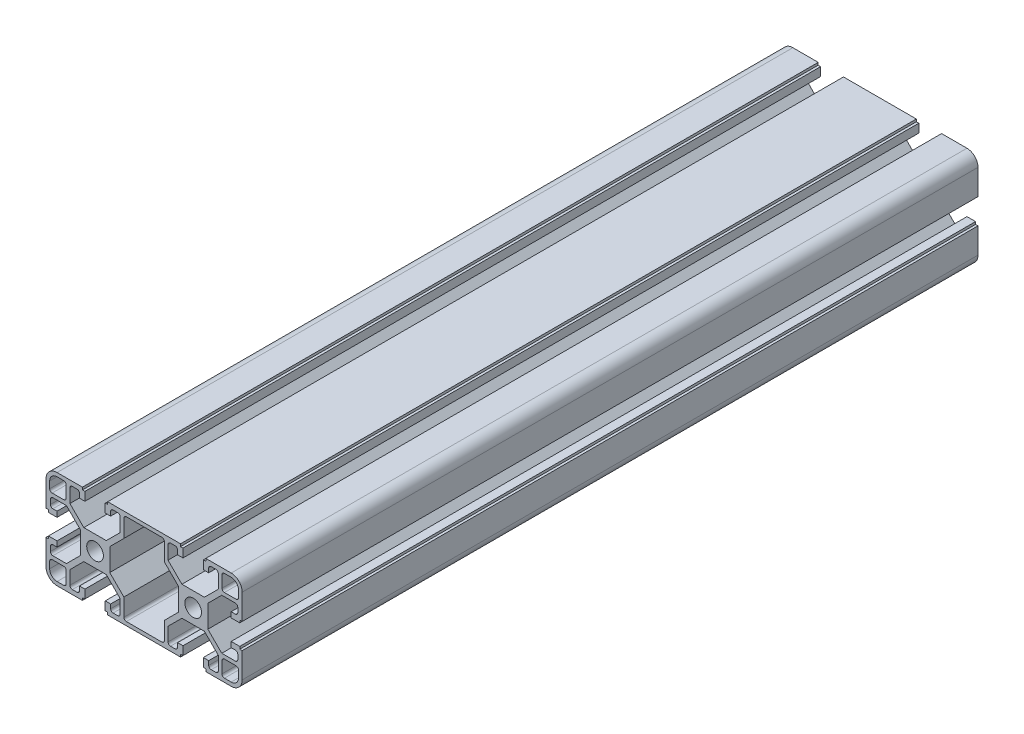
SolidWorks part; units mm, degrees
ref_plane "前视基准面" through (0, 0, 0) normal (0, 0, 1) x (1, 0, 0)
ref_plane "上视基准面" through (0, 0, 0) normal (0, 1, 0) x (1, 0, 0)
ref_plane "右视基准面" through (0, 0, 0) normal (1, 0, 0) x (0, 0, -1)
sketch "草图2"
sketch_block_instance "A$C493B3622-1"
sketch_block "A$C493B3622"
extrude "凸台-拉伸1" add sketch "草图2" along normal mid plane 300
